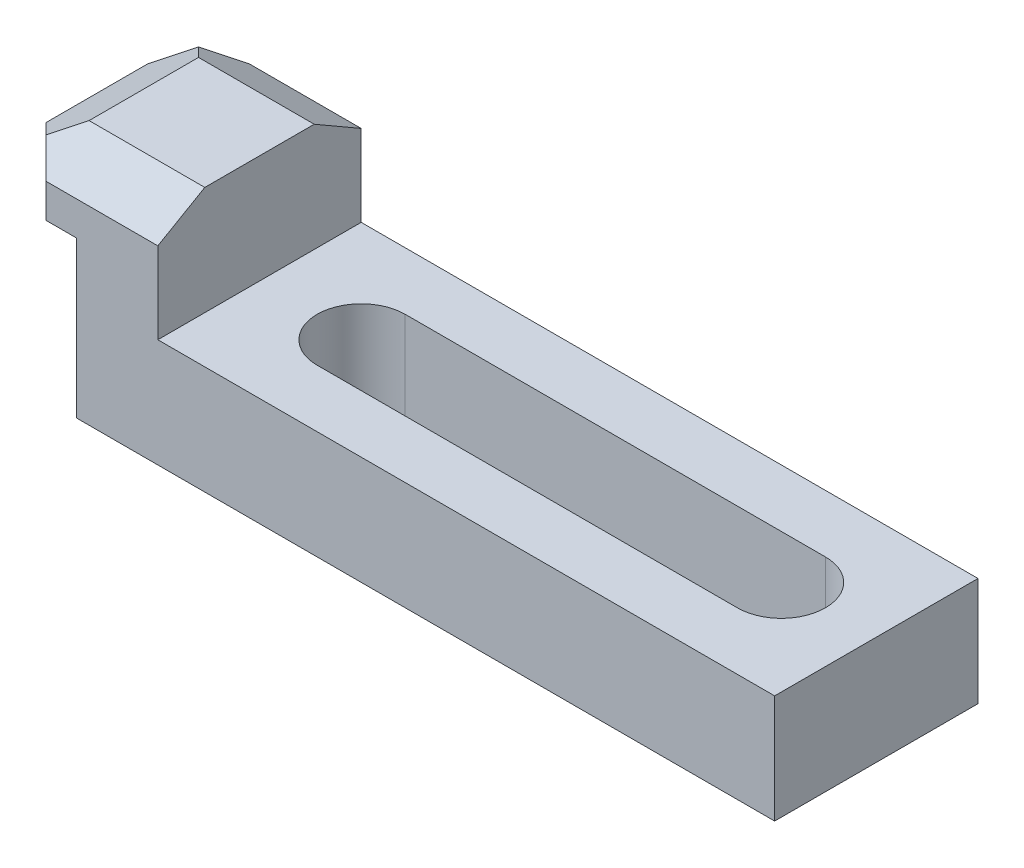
SolidWorks part; units mm, degrees
ref_plane "Front Plane" through (0, 0, 0) normal (0, 0, 1) x (1, 0, 0)
ref_plane "Top Plane" through (0, 0, 0) normal (0, 1, 0) x (1, 0, 0)
ref_plane "Right Plane" through (0, 0, 0) normal (1, 0, 0) x (0, 0, -1)
sketch "Sketch1" plane through (0, 0, 0) normal (0, 0, 1) x (1, 0, 0)
  line L0 (0, 0) -> (12, 0)
  line L1 (12, 0) -> (12, -23)
  line L2 (12, -23) -> (115, -23)
  line L3 (115, -23) -> (115, -7)
  line L4 (115, -7) -> (24, -7)
  line L5 (24, -7) -> (24, 9)
  line L6 (24, 9) -> (0, 9)
  line L7 (0, 9) -> (0, 0)
  dimension "D1" = 12
  dimension "D2" = 23
  dimension "D3" = 115
  dimension "D4" = 24
  dimension "D5" = 16
  dimension "D6" = 32
extrude "Extrude1" add sketch "Sketch1" along normal mid plane 30
chamfer "Chamfer1" distance 4 angle 60 4 edges at (12, 9, -15) (0, 9, 0) (12, 9, 15) (24, 9, 0)
sketch "Sketch2" plane through (0, -23, 0) normal (0, -1, 0) x (1, 0, 0)
  line L0 (0, 0) -> (50000, 0) construction
  line L1 (39, 6.5) -> (101, 6.5)
  line L2 (0, 15) -> (7.5, 15)
  line L4 (7.5, 15) -> (0, 7.5)
  line L5 (0, 15) -> (0, -15) construction
  line L6 (0, 7.5) -> (0, 15)
  line L7 (39, -6.5) -> (101, -6.5)
  line L8 (0, -7.5) -> (0, -15)
  line L9 (7.5, -15) -> (0, -7.5)
  line L10 (0, -15) -> (7.5, -15)
  arc A0 (39, 6.5) -> (39, -6.5) centre (39, 0) ccw
  arc A1 (101, -6.5) -> (101, 6.5) centre (101, 0) ccw
  point P18 (32.5, 0)
  point P19 (107.5, 0)
  dimension "D1" = 45
  dimension "D2" = 15
  dimension "D3" = 32.5
  dimension "D4" = 13
  dimension "D5" = 75
extrude "Extrude2" cut sketch "Sketch2" against normal through all
